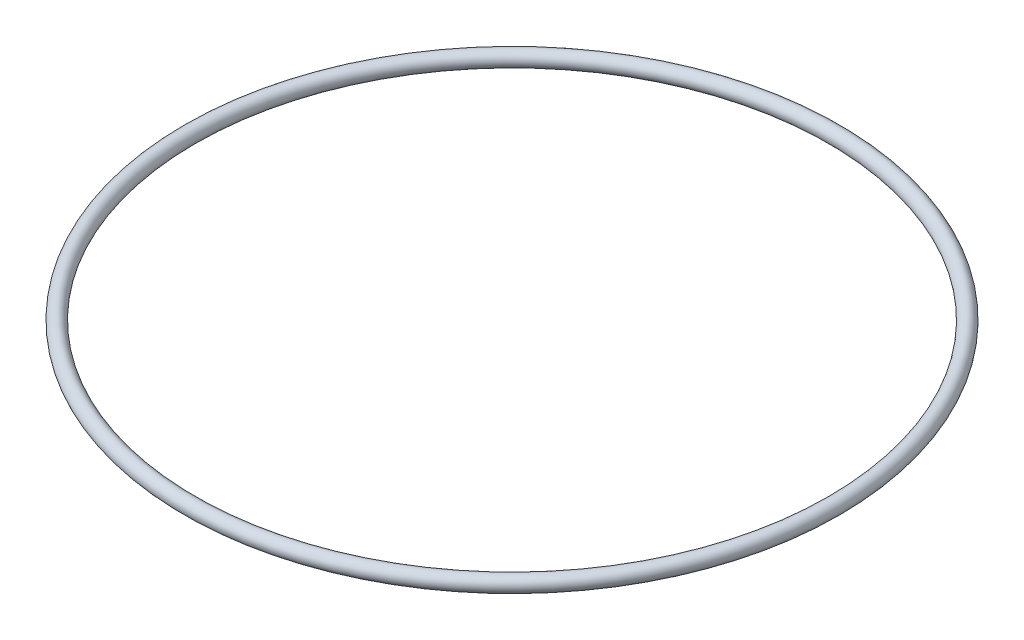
SolidWorks part; units mm, degrees
ref_plane "Plan1" through (0, 0, 0) normal (0, 0, 1) x (1, 0, 0)
ref_plane "Plan2" through (0, 0, 0) normal (0, 1, 0) x (1, 0, 0)
ref_plane "Plan3" through (0, 0, 0) normal (1, 0, 0) x (0, 0, -1)
sketch "Esquisse1" plane through (0, 0, 0) normal (0, 0, 1) x (1, 0, 0)
  line L1 (0, 0) -> (165, 0) construction
  line L2 (0, 2) -> (0, -2) construction
  circle A0 centre (84.5, 0) radius 2
  dimension "D2" = 84.5
  dimension "D1" = 4
  dimension "Diamètre du tore" = 4
  dimension "Diamètre intérieur" = 165
revolve "Base-Révolution" add sketch "Esquisse1" angle 360 about L2
equation " \"D1@Esquisse1\"=\"Diamètre du tore@Esquisse1\" "
equation "\"D2@Esquisse1\" = (\"Diamètre intérieur@Esquisse1\"/2)+(\"Diamètre du tore@Esquisse1\"/2)"
